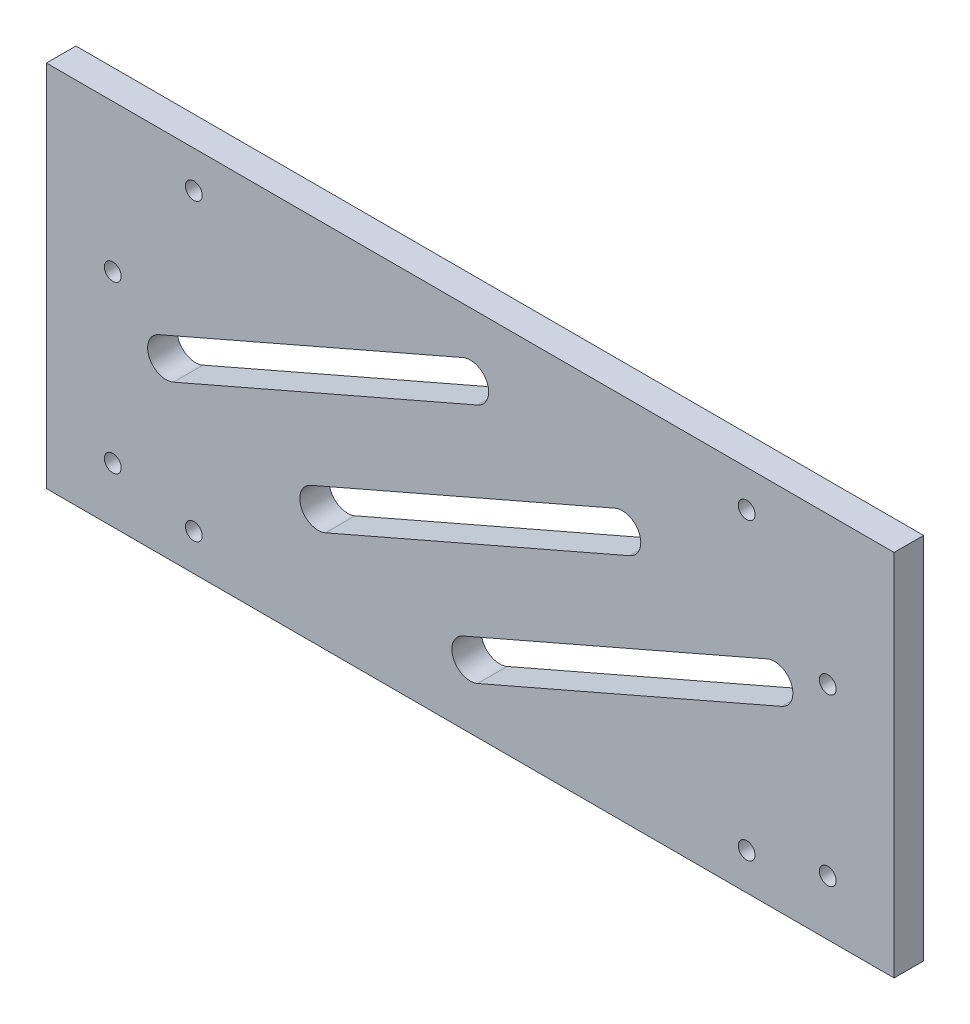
SolidWorks part; units mm, degrees
ref_plane "Front Plane" through (0, 0, 0) normal (0, 0, 1) x (1, 0, 0)
ref_plane "Top Plane" through (0, 0, 0) normal (0, 1, 0) x (1, 0, 0)
ref_plane "Right Plane" through (0, 0, 0) normal (1, 0, 0) x (0, 0, -1)
sketch "Sketch1" plane through (0, 0, 0) normal (0, 0, 1) x (1, 0, 0)
  line L0 (-139.859, 0) -> (143.75, 0) construction
  line L1 (0, 107.7585) -> (0, -112.9464) construction
  line L2 (-115, 50) -> (-115, -50)
  line L3 (-115, -50) -> (115, -50)
  line L4 (115, -50) -> (115, 50)
  line L5 (115, 50) -> (-115, 50)
  line L6 (-139.859, -40) -> (149.1284, -40) construction
  line L7 (-139.859, 40) -> (149.1284, 40) construction
  line L8 (-97, 62.4638) -> (-97, -78.8465) construction
  line L9 (97, 62.4638) -> (97, -78.8465) construction
  line L10 (-135.5109, 10) -> (143.75, 10) construction
  line L11 (-135.5109, -35) -> (149.1284, -35) construction
  line L12 (-75, 66.8683) -> (-75, -72.0562) construction
  line L13 (75, 66.8683) -> (75, -72.0562) construction
  line L14 (-115, -50) -> (115, 50) construction
  line L15 (0, -32.7129) -> (82.5363, 3.1725) construction
  line L16 (-82.5363, -3.1725) -> (0, 32.7129) construction
  line L17 (-41.2682, -17.9427) -> (41.2682, 17.9427) construction
  line L18 (-82.5363, -3.1725) -> (0, 32.7129) construction
  line L19 (-84.5299, 1.4129) -> (-1.9936, 37.2982)
  line L20 (-80.5427, -7.7578) -> (1.9936, 28.1275)
  line L21 (-41.2682, -17.9427) -> (41.2682, 17.9427) construction
  line L22 (-43.2618, -13.3573) -> (39.2745, 22.528)
  line L23 (-39.2745, -22.528) -> (43.2618, 13.3573)
  line L24 (0, -32.7129) -> (82.5363, 3.1725) construction
  line L25 (-1.9936, -28.1275) -> (80.5427, 7.7578)
  line L26 (1.9936, -37.2982) -> (84.5299, -1.4129)
  circle A0 centre (-97, 10) radius 2.285
  circle A1 centre (-97, -35) radius 2.285
  circle A2 centre (-75, -40) radius 2.285
  circle A3 centre (75, -40) radius 2.285
  circle A4 centre (97, -35) radius 2.285
  circle A5 centre (97, 10) radius 2.285
  circle A6 centre (75, 40) radius 2.285
  circle A7 centre (-75, 40) radius 2.285
  arc A8 (-84.5299, 1.4129) -> (-80.5427, -7.7578) centre (-82.5363, -3.1725) ccw
  arc A9 (1.9936, 28.1275) -> (-1.9936, 37.2982) centre (0, 32.7129) ccw
  arc A10 (-43.2618, -13.3573) -> (-39.2745, -22.528) centre (-41.2682, -17.9427) ccw
  arc A11 (43.2618, 13.3573) -> (39.2745, 22.528) centre (41.2682, 17.9427) ccw
  arc A12 (-1.9936, -28.1275) -> (1.9936, -37.2982) centre (0, -32.7129) ccw
  arc A13 (84.5299, -1.4129) -> (80.5427, 7.7578) centre (82.5363, 3.1725) ccw
  point P7 (0, -50)
  point P10 (115, 0)
  point P27 (-97, -35)
  point P28 (-75, -40)
  point P32 (-97, 10)
  point P33 (97, -35)
  point P34 (97, 10)
  point P50 (0, 0)
  point P51 (-41.2682, 14.7702)
  point P60 (0, 0)
  point P65 (41.2682, -14.7702)
  dimension "D7" = 4.57
  dimension "D8" = 4.57
  dimension "D9" = 4.57
  dimension "D16" = 5
  dimension "D17" = 5
  dimension "D18" = 5
  dimension "D1" = 230
  dimension "D2" = 100
  dimension "D3" = 10
  dimension "D4" = 18
  dimension "D5" = 60
  dimension "D6" = 15
  dimension "D10" = 40
  dimension "D11" = 30
  dimension "D12" = 30
  dimension "D13" = 90
  dimension "D14" = 90
  dimension "D15" = 90
extrude "Boss-Extrude1" add sketch "Sketch1" along normal blind 8
